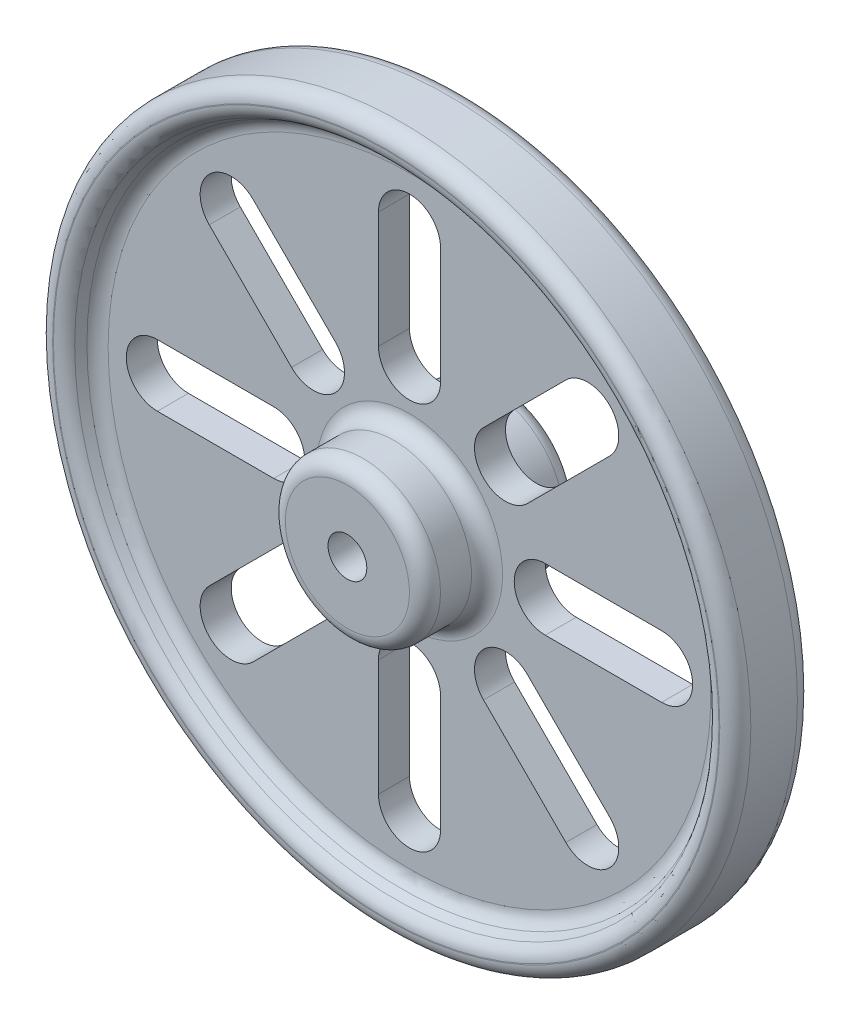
SolidWorks part; units mm, degrees
ref_plane "Front Plane" through (0, 0, 0) normal (0, 0, 1) x (1, 0, 0)
ref_plane "Top Plane" through (0, 0, 0) normal (0, 1, 0) x (1, 0, 0)
ref_plane "Right Plane" through (0, 0, 0) normal (1, 0, 0) x (0, 0, -1)
sketch "Sketch1" plane through (0, 0, 0) normal (0, 0, 1) x (1, 0, 0)
  circle A0 centre (0, 0) radius 10
  dimension "D1" = 20
extrude "Boss-Extrude1" add sketch "Sketch1" along normal mid plane 20
sketch "Sketch2" plane through (0, 0, 0) normal (1, 0, 0) x (0, 0, -1)
  line L0 (0, 10) -> (0, 70.7162) construction
  line L1 (10, 10) -> (-10, 10) construction
  line L2 (-2, 10) -> (2, 10)
  line L3 (2, 10) -> (2, 40)
  line L4 (2, 40) -> (5, 41.7321)
  line L5 (5, 41.7321) -> (5, 45)
  line L6 (5, 45) -> (-5, 45)
  line L7 (-5, 41.7321) -> (-5, 45)
  line L8 (-2, 40) -> (-5, 41.7321)
  line L9 (-2, 10) -> (-2, 40)
  point P11 (0, 45)
  dimension "D1" = 30
  dimension "D2" = 4
  dimension "D3" = 10
  dimension "D4" = 30
  dimension "D5" = 35
revolve "Revolve1" add sketch "Sketch2" angle 360 about axis through (0, 0, 10) along (0, 0, -1)
sketch "Sketch3" plane through (0, 0, 2) normal (0, 0, 1) x (1, 0, 0)
  line L0 (0, 17.5) -> (0, 32.5) construction
  line L1 (-4, 17.5) -> (-4, 32.5)
  line L2 (4, 17.5) -> (4, 32.5)
  arc A0 (-4, 17.5) -> (4, 17.5) centre (0, 17.5) ccw
  arc A1 (4, 32.5) -> (-4, 32.5) centre (0, 32.5) ccw
  circle A2 centre (0, 0) radius 25 construction
  point P2 (0, 25)
  dimension "D1" = 50
  dimension "D2" = 4
  dimension "D3" = 15
extrude "Cut-Extrude1" cut sketch "Sketch3" against normal through all
pattern_circular "CirPattern1" count 8 over 360 about axis through (0, 0, 0) along (0, 0, 1) of "Cut-Extrude1"
hole_wizard "Ø5.0 (5) Diameter Hole1" positions "Sketch5" profile "Sketch4" hole size "Ø5.0" standard "ANSI Metric"
sketch "Sketch5" plane through (0, 0, 10) normal (0, 0, 1) x (1, 0, 0)
  point P0 (0, 0)
sketch "Sketch4" plane through (0, 0, 10) normal (1, 0, 0) x (0, -1, 0)
  line L0 (0, 0) -> (0, 20)
  line L1 (0, 20) -> (2.5, 20)
  line L2 (2.5, 20) -> (2.5, 0)
  line L5 (2.5, 0) -> (0, 0)
  line L11 (0, -6.35) -> (0, 107.95) construction
  dimension "Thru Hole Dia." = 5
  dimension "Thru Hole Depth" = 20
fillet "Fillet1" radius 2 10 edges at (45, 0, 5) (41.7321, 0, -5) (45, 0, -5) (10, 0, -2) (10, 0, -10) (40, 0, 2) (-10, 0, 2) (10, 0, 10) (40, 0, -2) (41.7321, 0, 5)
